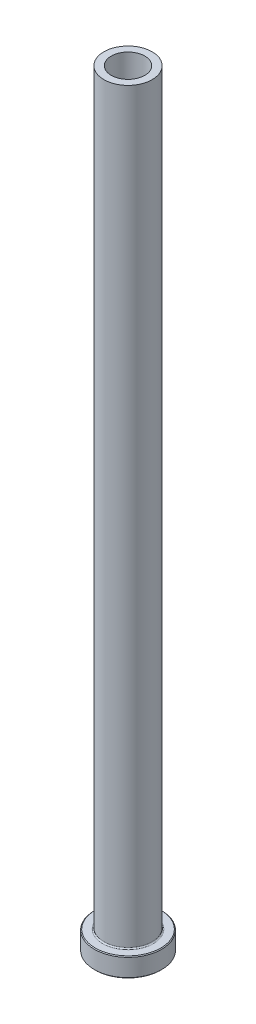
SolidWorks part; units mm, degrees
ref_plane "Front Plane" through (0, 0, 0) normal (0, 0, 1) x (1, 0, 0)
ref_plane "Top Plane" through (0, 0, 0) normal (0, 1, 0) x (1, 0, 0)
ref_plane "Right Plane" through (0, 0, 0) normal (1, 0, 0) x (0, 0, -1)
sketch "Sketch1" plane through (0, 0, 0) normal (0, 0, 1) x (1, 0, 0)
  line L0 (0, 0) -> (0, 50000) construction
  line L1 (0, 0) -> (11.1125, 0)
  line L2 (11.1125, 0) -> (11.1125, 6.35)
  line L3 (11.1125, 6.35) -> (8.3915, 6.35)
  line L4 (7.9947, 6.7469) -> (7.9947, 254)
  line L5 (7.9947, 254) -> (0, 254)
  line L6 (0, 254) -> (0, 0)
  arc A0 (7.9947, 6.7469) -> (8.3915, 6.35) centre (8.3915, 6.7469) ccw
  dimension "D5" = 0.3969
  dimension "D1" = 15.9893
  dimension "D2" = 22.225
  dimension "D3" = 6.35
  dimension "D4" = 254
revolve "Revolve1" add sketch "Sketch1" angle 360 about L0
sketch "Sketch2" plane through (0, 0, 0) normal (0, 0, 1) x (1, 0, 0)
  line L0 (0, 0) -> (0, 50000) construction
  line L1 (-11.1125, 0) -> (11.1125, 0) construction
  line L2 (6.1436, 0) -> (5.7468, 0.3969)
  line L3 (5.7468, 0.3969) -> (5.7468, 179.5145)
  line L4 (5.7468, 179.5145) -> (5.5562, 193.802)
  line L5 (5.5562, 193.802) -> (5.5562, 254)
  line L6 (7.9947, 254) -> (-7.9947, 254) construction
  line L7 (5.5562, 254) -> (0, 254)
  line L8 (0, 254) -> (0, 0)
  line L9 (0, 0) -> (6.1436, 0)
  point P4 (0, 0)
  dimension "D1" = 0.3969
  dimension "D2" = 45
  dimension "D3" = 11.1125
  dimension "D4" = 11.4935
  dimension "D5" = 60.198
  dimension "D6" = 14.2875
revolve "Cut-Revolve1" cut sketch "Sketch2" angle 360 about L0
chamfer "Chamfer1" distance 0.254 angle 45 2 edges at (0, 0, -11.1125) (0, 6.35, -11.1125)
